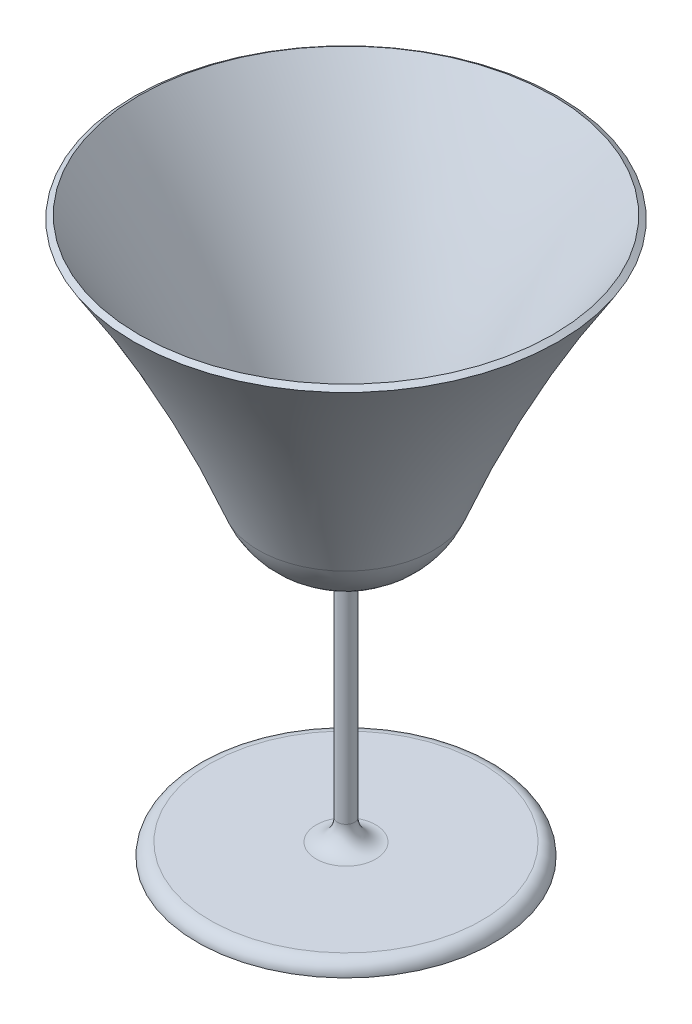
SolidWorks part; units mm, degrees
ref_plane "Front Plane" through (0, 0, 0) normal (0, 0, 1) x (1, 0, 0)
ref_plane "Top Plane" through (0, 0, 0) normal (0, 1, 0) x (1, 0, 0)
ref_plane "Right Plane" through (0, 0, 0) normal (1, 0, 0) x (0, 0, -1)
sketch "Sketch1" plane through (0, 0, 0) normal (0, 0, 1) x (1, 0, 0)
  line L0 (0, 0) -> (-35, 0)
  line L1 (-32, 3) -> (-7, 3)
  line L2 (-2, 8) -> (-2, 60)
  line L4 (-2, 60) -> (0, 60)
  line L5 (0, 60) -> (0, 0)
  arc A0 (-35, 0) -> (-32, 3) centre (-32, 0) cw
  arc A1 (-7, 3) -> (-2, 8) centre (-7, 8) ccw
  dimension "D4" = 5
  dimension "D5" = 60
  dimension "D1" = 35
  dimension "D2" = 3
  dimension "D3" = 2
revolve "Revolve1" add sketch "Sketch1" angle 360 about L5
sketch "Sketch2" plane through (0, 0, 0) normal (0, 0, 1) x (1, 0, 0)
  line L2 (2, 60) -> (-2, 60) construction
  line L3 (0, 86.6586) -> (0, 120.6924) construction
  arc A0 (-2, 60) -> (-20.6702, 72.8291) centre (-2, 80) cw
  arc A1 (-20.6702, 72.8291) -> (-50, 130) centre (-300.7238, -34.7349) ccw
  dimension "D1" = 20
  dimension "D3" = 300
  dimension "D2" = 130
  dimension "D4" = 50
revolve "Revolve-Thin1" add sketch "Sketch2" angle 360 about L3
